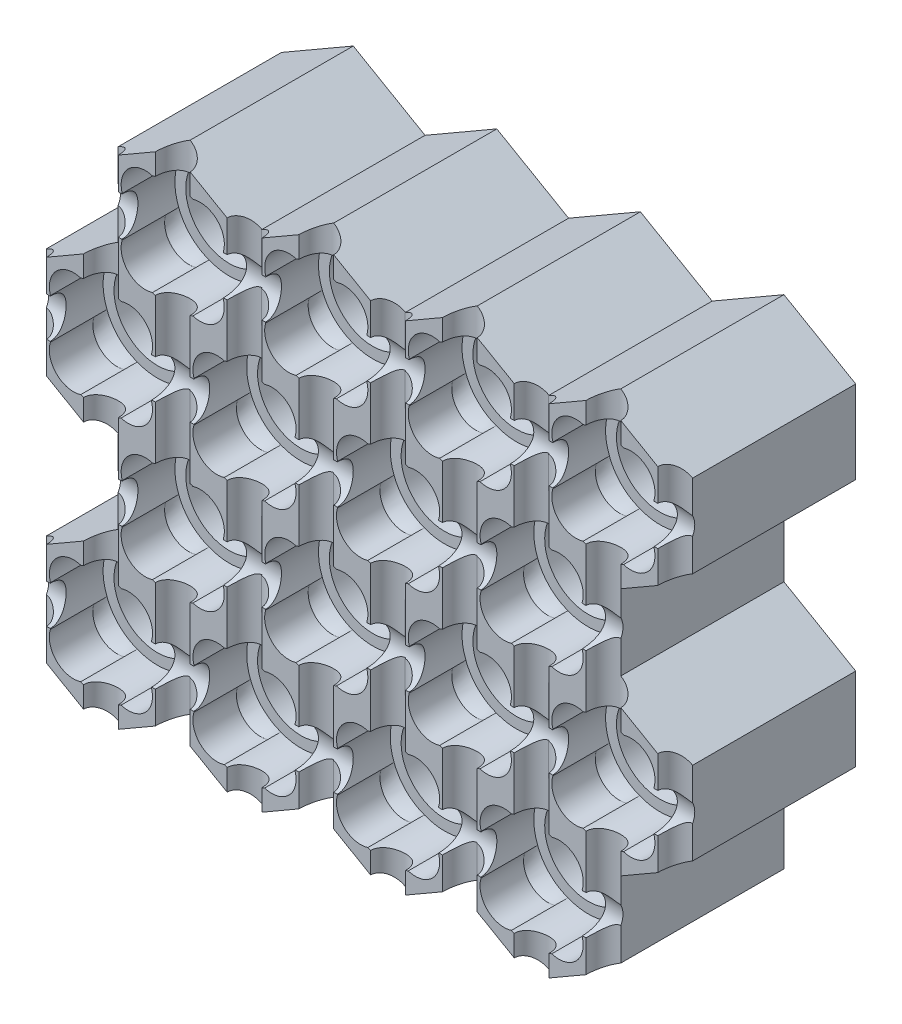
SolidWorks part; units mm, degrees
ref_plane "Front Plane" through (0, 0, 0) normal (0, 0, 1) x (1, 0, 0)
ref_plane "Top Plane" through (0, 0, 0) normal (0, 1, 0) x (1, 0, 0)
ref_plane "Right Plane" through (0, 0, 0) normal (1, 0, 0) x (0, 0, -1)
other "Join1"
other "majmold3fixed<1>@assemblybottom"
other "majmold3fixed<11>@assemblybottom"
other "majmold3fixed<107>@assemblybottom"
other "majmold3fixed<108>@assemblybottom"
other "majmold3fixed<109>@assemblybottom"
other "majmold3fixed<110>@assemblybottom"
other "majmold3fixed<111>@assemblybottom"
other "majmold3fixed<112>@assemblybottom"
other "majmold3fixed<113>@assemblybottom"
other "majmold3fixed<114>@assemblybottom"
other "majmold3fixed<115>@assemblybottom"
other "majmold3fixed<116>@assemblybottom"
other "majmold3fixed<117>@assemblybottom"
other "majmold3fixed<118>@assemblybottom"
other "majmold3fixed<119>@assemblybottom"
other "majmold3fixed<120>@assemblybottom"
